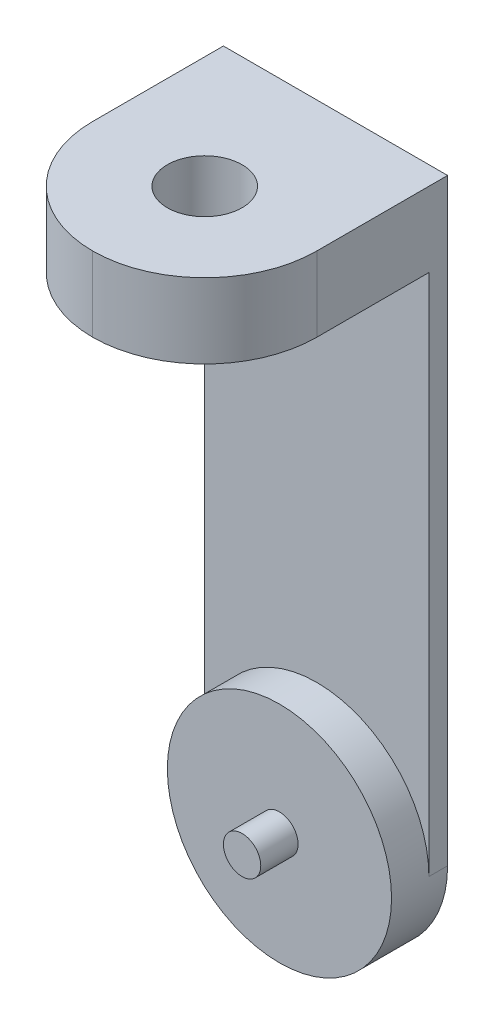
SolidWorks part; units mm, degrees
ref_plane "Płaszczyzna przednia" through (0, 0, 0) normal (0, 0, 1) x (1, 0, 0)
ref_plane "Płaszczyzna górna" through (0, 0, 0) normal (0, 1, 0) x (1, 0, 0)
ref_plane "Płaszczyzna prawa" through (0, 0, 0) normal (1, 0, 0) x (0, 0, -1)
sketch "Szkic1" plane through (0, 0, 0) normal (0, 0, 1) x (1, 0, 0)
  line L1 (0, 0) -> (60, 0)
  line L2 (0, 0) -> (0, 160)
  line L3 (0, 160) -> (60, 160)
  line L4 (60, 0) -> (60, 160)
  dimension "D1" = 160
  dimension "D2" = 60
extrude "Dodanie-wyciągnięcie1" add sketch "Szkic1" along normal blind 5
sketch "Szkic3" plane through (0, 0, 0) normal (0, 0, 1) x (1, 0, 0)
  line L0 (0, 0) -> (60, 0) construction
  line L1 (0, 0) -> (60, 0)
  arc A0 (0, 0) -> (60, 0) centre (30, 0) ccw
extrude "Dodanie-wyciągnięcie2" add sketch "Szkic3" along normal blind 5
sketch "Szkic4" plane through (0, 0, 5) normal (0, 0, 1) x (1, 0, 0)
  circle A0 centre (30, 0) radius 30
  arc A1 (0, 0) -> (60, 0) centre (30, 0) ccw construction
extrude "Dodanie-wyciągnięcie3" add sketch "Szkic4" along normal blind 10
sketch "Szkic5" plane through (0, 0, 15) normal (0, 0, 1) x (1, 0, 0)
  circle A0 centre (30, 0) radius 5
  dimension "D1" = 10
extrude "Dodanie-wyciągnięcie4" add sketch "Szkic5" along normal blind 10
sketch "Szkic6" plane through (0, 160, 0) normal (0, 1, 0) x (1, 0, 0)
  line L1 (0, -5) -> (60, -5)
  line L2 (0, -5) -> (0, -65)
  line L3 (0, -65) -> (60, -65)
  line L4 (60, -5) -> (60, -65)
  dimension "D1" = 60
extrude "Dodanie-wyciągnięcie5" add sketch "Szkic6" against normal blind 20
fillet "Zaokrąglenie1" radius 30 2 edges at (60, 150, 65) (0, 150, 65)
sketch "Szkic7" plane through (0, 160, 0) normal (0, 1, 0) x (1, 0, 0)
  circle A0 centre (30, -35) radius 10
  arc A1 (0, -35) -> (30, -65) centre (30, -35) ccw construction
  dimension "D1" = 20
extrude "Wytnij-wyciągnięcie1" cut sketch "Szkic7" against normal up to next
sketch "Szkic8" plane through (0, 140, 0) normal (0, -1, 0) x (1, 0, 0)
  line L0 (30, 65) -> (30, 35) construction
  circle A0 centre (30, 55) radius 2.5
  point P5 (30, 65)
  point P6 (30, 38.0183)
  point P7 (30, 31.1204)
  point P8 (30, 35)
  point P9 (30, 45)
  point P10 (24.3093, 57.5047)
  dimension "D2" = 5
  dimension "D1" = 20
extrude "Dodanie-wyciągnięcie6" add sketch "Szkic8" along normal blind 5
